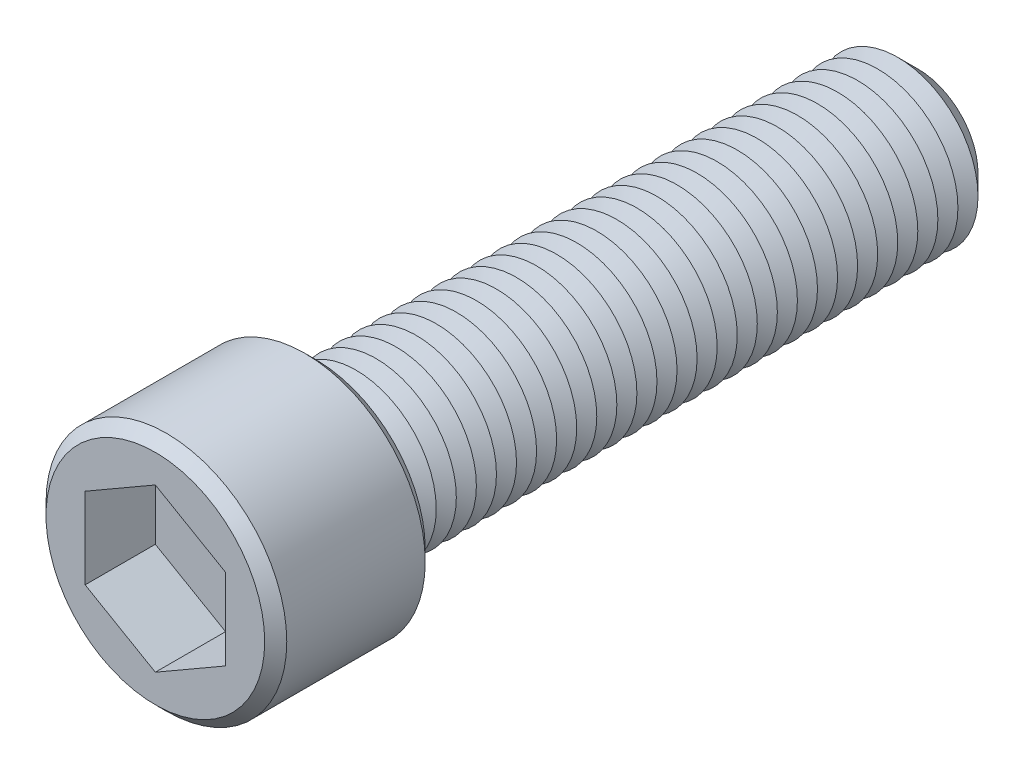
SolidWorks part; units mm, degrees
ref_plane "Front Plane" through (0, 0, 0) normal (0, 0, 1) x (1, 0, 0)
ref_plane "Top Plane" through (0, 0, 0) normal (0, 1, 0) x (1, 0, 0)
ref_plane "Right Plane" through (0, 0, 0) normal (1, 0, 0) x (0, 0, -1)
sketch "Sketch1" plane through (0, 0, 0) normal (0, 0, 1) x (1, 0, 0)
  circle A0 centre (0, 0) radius 12
  dimension "D1" = 24
extrude "Boss-Extrude1" add sketch "Sketch1" along normal blind 16
sketch "Sketch2" plane through (0, 0, 0) normal (0, 0, -1) x (-1, 0, 0)
  circle A0 centre (0, 0) radius 8
  dimension "D1" = 16
extrude "Boss-Extrude2" add sketch "Sketch2" along normal blind 60
chamfer "Chamfer1" distance 2 angle 45 1 edges at (-8, 0, -60)
sketch "Sketch3" plane through (0, 0, 0) normal (1, 0, 0) x (0, 0, -1)
  line L0 (-2.5121, 0) -> (4.5776, 0) construction
sketch "Sketch4" plane through (0, 0, 0) normal (1, 0, 0) x (0, 0, -1)
  line L0 (0, 8) -> (1, 6.2679)
  line L1 (1, 6.2679) -> (2, 8)
  line L2 (58, 8) -> (0, 8) construction
  line L3 (2, 8) -> (0, 8)
  dimension "D1" = 2
revolve "Cut-Revolve1" cut sketch "Sketch4" angle 360 about L0
pattern_linear "LPattern1" count 29 spacing 2 along (0, 0, -1) of "Cut-Revolve1"
sketch "Sketch5" plane through (0, 0, 16) normal (0, 0, 1) x (1, 0, 0)
  line L1 (0, 8.0829) -> (-7, 4.0415)
  line L2 (-7, 4.0415) -> (-7, -4.0415)
  line L3 (-7, -4.0415) -> (0, -8.0829)
  line L4 (0, -8.0829) -> (7, -4.0415)
  line L5 (7, -4.0415) -> (7, 4.0415)
  line L6 (7, 4.0415) -> (0, 8.0829)
  circle A0 centre (0, 0) radius 7 construction
  dimension "D1" = 14
extrude "Cut-Extrude1" cut sketch "Sketch5" against normal blind 7
sketch "Sketch6" plane through (0, 0, 9) normal (0, 0, 1) x (1, 0, 0)
  circle A0 centre (0, 0) radius 0.9
  dimension "D1" = 1.8
extrude "Cut-Extrude2" cut sketch "Sketch6" against normal up to surface (69 mm away)
chamfer "Chamfer2" distance 1.1 angle 45 2 edges at (12, 0, 0) (12, 0, 16)
